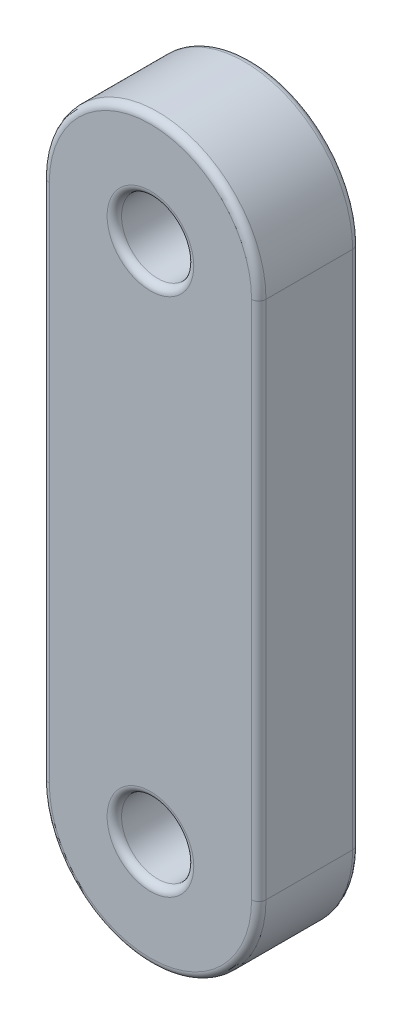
SolidWorks part; units mm, degrees
ref_plane "Спереди" through (0, 0, 0) normal (0, 0, 1) x (1, 0, 0)
ref_plane "Сверху" through (0, 0, 0) normal (0, 1, 0) x (1, 0, 0)
ref_plane "Справа" through (0, 0, 0) normal (1, 0, 0) x (0, 0, -1)
sketch "Эскиз1" plane through (0, 0, 0) normal (0, 0, 1) x (1, 0, 0)
  line L0 (0, 0) -> (0, 18.0025) construction
  line L1 (0, 0) -> (0, -18.0025) construction
  line L2 (-7.5, 18.0025) -> (-7.5, -18.0025)
  line L3 (7.5, 18.0025) -> (7.5, -18.0025)
  circle A0 centre (0, 18.0025) radius 2.5
  circle A1 centre (0, -18.0025) radius 2.5
  arc A2 (7.5, 18.0025) -> (-7.5, 18.0025) centre (0, 18.0025) ccw
  arc A3 (-7.5, -18.0025) -> (7.5, -18.0025) centre (0, -18.0025) ccw
  dimension "D2" = 5
  dimension "D3" = 15
  dimension "D1" = 36.005
extrude "Бобышка-Вытянуть1" add sketch "Эскиз1" along normal mid plane 7
fillet "Скругление1" radius 0.5 12 edges at (2.5, -18.0025, -3.5) (-7.5, 0, -3.5) (0, -25.5025, -3.5) (7.5, 0, -3.5) (0, 25.5025, -3.5) (2.5, 18.0025, -3.5) (2.5, -18.0025, 3.5) (7.5, 0, 3.5) (0, -25.5025, 3.5) (-7.5, 0, 3.5) (0, 25.5025, 3.5) (2.5, 18.0025, 3.5)
